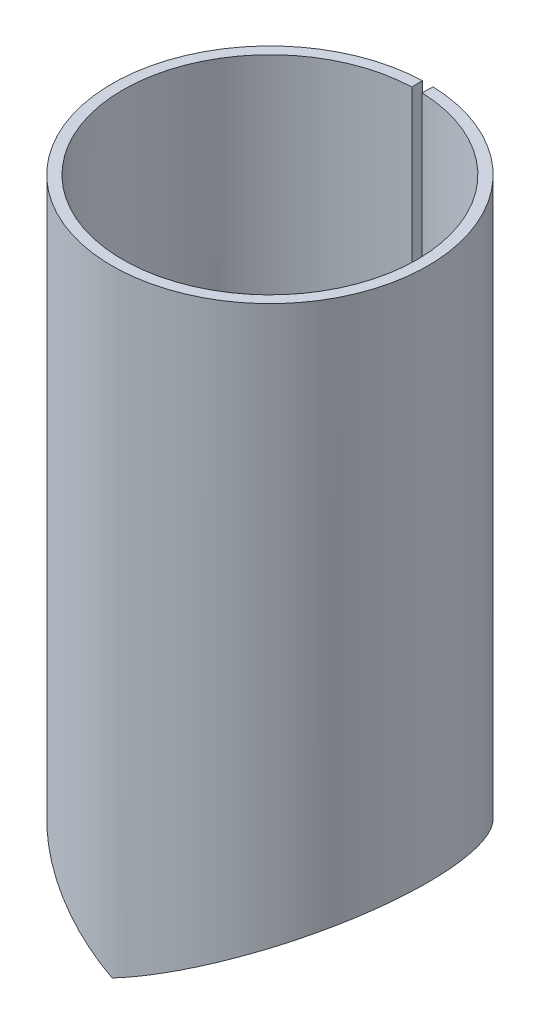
SolidWorks part; units mm, degrees
ref_plane "前视基准面" through (0, 0, 0) normal (0, 0, 1) x (1, 0, 0)
ref_plane "上视基准面" through (0, 0, 0) normal (0, 1, 0) x (1, 0, 0)
ref_plane "右视基准面" through (0, 0, 0) normal (1, 0, 0) x (0, 0, -1)
imported_body "基体零件-任意角度Y形三通管-1"
sheet metal parameters "钣金1" parameters "D1"=0.7366, "厚度"=1
bend "圆角折弯1" bend radius 13.6769 bend angle 356.095 parameters "D5"=1
flatten bends "展开-折弯1"
sketch "尖角-草图1" plane through (0.5, 28.8026, -14.6684) normal (0.0341, 0, -0.9994) x (-0.9994, 0, -0.0341)
  line L0 (-42.5011, -28.5407) -> (-42.5011, 28.5407) construction
  dimension "D1" = 0
process bends "加工-折弯1" parameters "D1"=0
sketch "平面-草图1" plane through (0.5, 28.8026, -14.6684) normal (0.0341, 0, -0.9994) x (-0.9994, 0, -0.0341)
